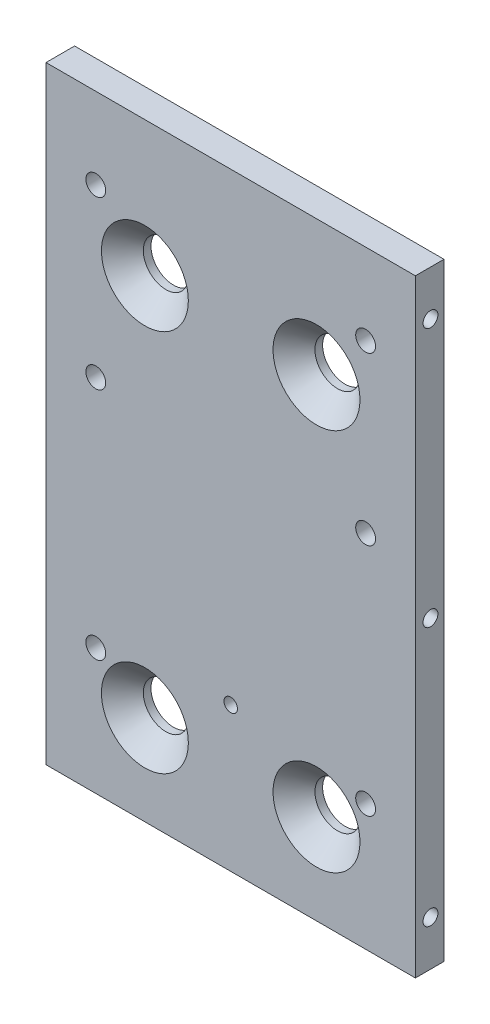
SolidWorks part; units mm, degrees
ref_plane "Front Plane" through (0, 0, 0) normal (0, 0, 1) x (1, 0, 0)
ref_plane "Top Plane" through (0, 0, 0) normal (0, 1, 0) x (1, 0, 0)
ref_plane "Right Plane" through (0, 0, 0) normal (1, 0, 0) x (0, 0, -1)
sketch "Sketch1" plane through (0, 0, 0) normal (0, 0, 1) x (1, 0, 0)
  line L1 (41, 67.5) -> (-41, 67.5)
  line L2 (41, 67.5) -> (41, -67.5)
  line L3 (41, -67.5) -> (-41, -67.5)
  line L4 (-41, 67.5) -> (-41, -67.5)
  line L5 (41, 67.5) -> (-41, -67.5) construction
  line L6 (41, -67.5) -> (-41, 67.5) construction
  point P0 (0, 0)
  dimension "D1" = 82
  dimension "D2" = 135
extrude "Boss-Extrude1" add sketch "Sketch1" along normal blind 6.35
sketch "Sketch2" plane through (0, 0, 6.35) normal (0, 0, 1) x (1, 0, 0)
  line L0 (41, 67.5) -> (-41, 67.5) construction
  point P0 (-19.05, 37.5)
  point P1 (19.05, 37.5)
  point P2 (19.05, -47.5)
  point P3 (-19.05, -47.5)
  dimension "D1" = 38.1
  dimension "D2" = 19.05
  dimension "D3" = 85
  dimension "D4" = 30
hole_wizard "CSK for M8 Flat Head Machine Screw1" positions "Sketch3" profile "Sketch4" countersink size "M8" standard "ANSI Metric"
sketch "Sketch3" plane through (0, 0, 6.35) normal (0, 0, 1) x (1, 0, 0)
  point P0 (-19.05, 37.5)
  point P3 (19.05, 37.5)
  point P6 (-19.05, -47.5)
  point P9 (19.05, -47.5)
sketch "Sketch4" plane through (-19.05, 37.5, 6.35) normal (1, 0, 0) x (0, -1, 0)
  line L0 (0, 0) -> (0, 6.35)
  line L1 (0, 6.35) -> (5, 6.35)
  line L2 (5, 6.35) -> (5, 4.65)
  line L3 (5, 4.65) -> (9.65, 0)
  line L5 (9.65, 0) -> (0, 0)
  line L6 (-5, 4.65) -> (-9.65, 0) construction
  line L11 (0, -6.35) -> (0, 107.95) construction
  dimension "Thru Hole Dia." = 10
  dimension "Thru Hole Depth" = 6.35
  dimension "Near C'Sink Dia." = 19.3
  dimension "Near C'Sink Angle" = 90
sketch "Sketch9" plane through (0, 0, 0) normal (0, 0, -1) x (-1, 0, 0)
  line L0 (41, -67.5) -> (-41, -67.5) construction
  circle A0 centre (0, -35.5) radius 1.5
  point P4 (0, -67.5)
  dimension "D1" = 3
  dimension "D2" = 32
extrude "Cut-Extrude2" cut sketch "Sketch9" against normal through all contours A0
sketch "Sketch11" plane through (0, 0, 0) normal (0, 0, -1) x (-1, 0, 0)
  point P0 (29.95, 49.5)
  point P1 (-29.95, 49.5)
  point P3 (29.95, 12.5)
  point P5 (-29.95, 12.5)
  point P7 (29.95, -39.5)
  point P9 (-29.95, -39.5)
hole_wizard "Hole1" positions "Sketch12" profile "Sketch13" legacy
sketch "Sketch12" plane through (0, 0, 0) normal (0, 0, -1) x (-1, 0, 0)
  point P0 (-29.95, -39.5)
  point P3 (-29.95, 12.5)
  point P6 (-29.95, 49.5)
  point P9 (29.95, 49.5)
  point P12 (29.95, 12.5)
  point P15 (29.95, -39.5)
sketch "Sketch13" plane through (29.95, -39.5, 0) normal (1, 0, 0) x (0, 1, 0)
  line L0 (0, 0) -> (0, 6.35)
  line L1 (0, 6.35) -> (2.2, 6.35)
  line L2 (2.2, 6.35) -> (2.2, 3)
  line L3 (2.2, 3) -> (3.75, 3)
  line L4 (3.75, 3) -> (3.75, 0)
  line L5 (3.75, 0) -> (0, 0)
  line L6 (0, 110) -> (0, -10) construction
  dimension "Diameter" = 4.4
  dimension "Depth" = 6.35
  dimension "C-Bore Diameter" = 7.5
  dimension "C-Bore Depth" = 3
sketch "Sketch14" plane through (41, 0, 0) normal (1, 0, 0) x (0, 0, -1)
  circle A0 centre (-3, 57.5) radius 1.65
  circle A1 centre (-3, 0) radius 1.65
  circle A2 centre (-3, -57.5) radius 1.65
  dimension "D1" = 3.3
extrude "Cut-Extrude4" cut sketch "Sketch14" against normal blind 15
mirror "Mirror1" about plane through (0, 0, 0) normal (1, 0, 0) of "Cut-Extrude4"
